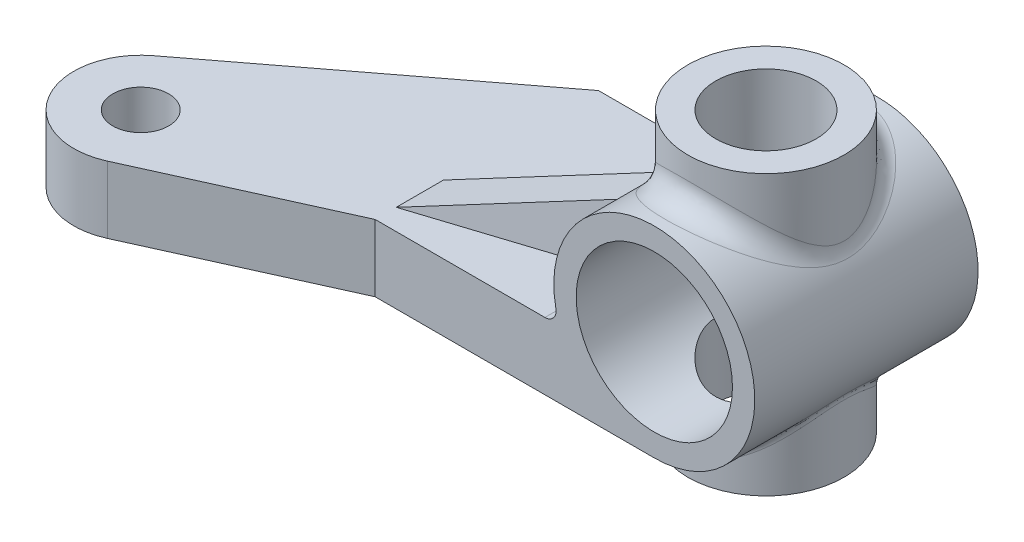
SolidWorks part; units mm, degrees
ref_plane "Alzado" through (0, 0, 0) normal (0, 0, 1) x (1, 0, 0)
ref_plane "Planta" through (0, 0, 0) normal (0, 1, 0) x (1, 0, 0)
ref_plane "Vista lateral" through (0, 0, 0) normal (1, 0, 0) x (0, 0, -1)
sketch "Croquis1" plane through (0, 0, 0) normal (0, 0, 1) x (1, 0, 0)
  circle A0 centre (0, 0) radius 4.5
  dimension "D1" = 9
extrude "Extruir1" add sketch "Croquis1" along normal blind 10
ref_plane "Plano1" through (0, -4.5, 0) normal (0, 1, 0) x (-1, 0, 0)
sketch "Croquis2" plane through (0, -4.5, 0) normal (0, 1, 0) x (-1, 0, 0)
  line L0 (0, 10) -> (0, 0)
  line L1 (4.5, 10) -> (-4.5, 10) construction
  line L2 (0, 0) -> (12.5, 0)
  line L3 (0, 10) -> (12.5, 10)
  line L4 (12.5, 0) -> (23.8168, 8.6127)
  line L5 (12.5, 10) -> (20.7648, 13.7339)
  arc A0 (20.7648, 13.7339) -> (23.8168, 8.6127) centre (22, 11) cw
  dimension "D3" = 3
  dimension "D1" = 12.5
  dimension "D2" = 12.5
  dimension "D4" = 26.5
  dimension "D5" = 11
extrude "Extruir2" add sketch "Croquis2" along normal blind 3
sketch "Croquis3" plane through (0, -4.5, 0) normal (0, 1, 0) x (-1, 0, 0)
  line L0 (0, 10) -> (0, 0) construction
  circle A0 centre (0, 5) radius 3.5
  dimension "D1" = 7
extrude "Extruir3" add sketch "Croquis3" along normal blind 11 and the other way blind 1.5
sketch "Croquis4" plane through (0, -6, 0) normal (0, -1, 0) x (1, 0, 0)
  circle A0 centre (0, 5) radius 2.25
  dimension "D1" = 4.5
extrude "Cortar-Extruir1" cut sketch "Croquis4" against normal through all
sketch "Croquis5" plane through (0, 0, 10) normal (0, 0, 1) x (1, 0, 0)
  circle A0 centre (0, 0) radius 3.5
  dimension "D1" = 7
extrude "Cortar-Extruir2" cut sketch "Croquis5" against normal through all
sketch "Croquis6" plane through (0, -4.5, 0) normal (0, -1, 0) x (1, 0, 0)
  circle A0 centre (-22, 11) radius 1.25
  dimension "D1" = 2.5
extrude "Cortar-Extruir3" cut sketch "Croquis6" against normal through all
sketch "Croquis7" plane through (0, -1.5, 0) normal (0, 1, 0) x (1, 0, 0)
  line L1 (-12.5, -10) -> (-12.5, -6) construction
  point P0 (-12.5, -8)
  dimension "D1" = 2
ref_plane "Plano2" through (-4.25, 0, 0) normal (1, 0, 0) x (0, 0, -1)
sketch "Croquis8" plane through (-4.25, 0, 0) normal (1, 0, 0) x (0, 0, -1)
  line L3 (0, -4.5) -> (0, 4.5) construction
  point P0 (-5, 1.479)
  point P5 (0, 1.479)
  point P8 (-10, 1.479)
  dimension "D1" = 5
ref_plane "Plano3" through (-0.9627, 2.666, 0) normal (0.3396, -0.9406, 0) x (0.9406, 0.3396, 0)
sketch "Croquis9" plane through (-0.9627, 2.666, 0) normal (0.3396, -0.9406, 0) x (0.9406, 0.3396, 0)
  line L0 (-12.2664, 8) -> (-3.4951, 5)
rib "Nervio1" sketch "Croquis9" sketch "Croquis9" thickness 2 extrusion direction normal to sketch draft on no parameters "D1"=2
fillet "Redondeo1" radius 1 1 edges at (0.122, 4.4983, 1.5021)
fillet "Redondeo2" radius 0.5 2 edges at (-4.2426, -1.5, 8.2003) (-4.2426, -1.5, 2.1434)
fillet "Redondeo3" radius 0.5 2 edges at (3.4716, -2.8633, 5.4452) (-3.5, -4.5, 5)
